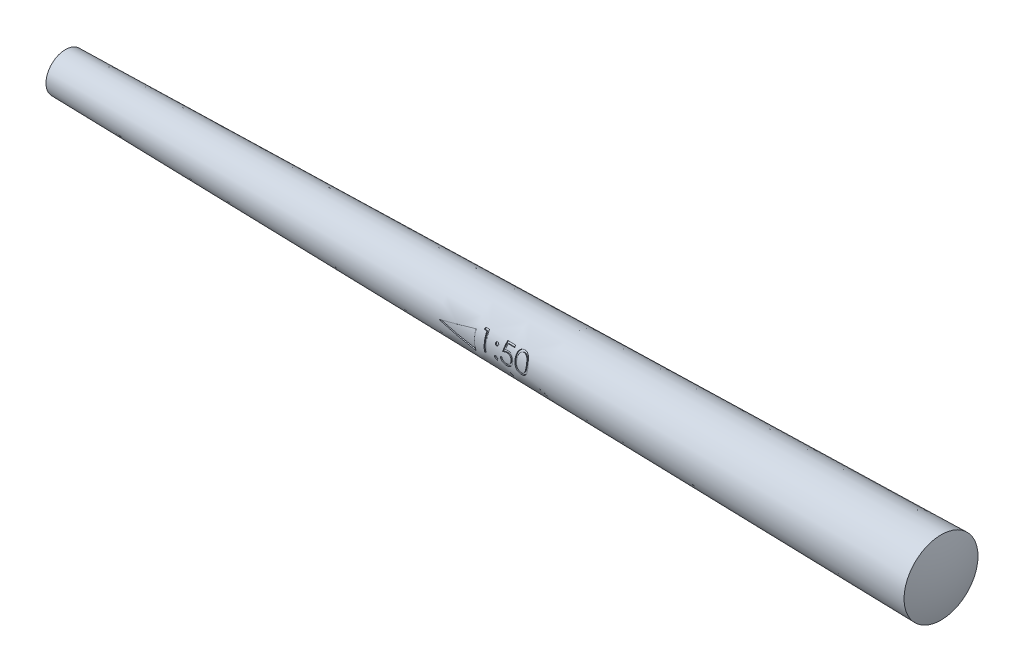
SolidWorks part; units mm, degrees
ref_plane "Front Plane" through (0, 0, 0) normal (0, 0, 1) x (1, 0, 0)
ref_plane "Top Plane" through (0, 0, 0) normal (0, 1, 0) x (1, 0, 0)
ref_plane "Right Plane" through (0, 0, 0) normal (1, 0, 0) x (0, 0, -1)
sketch "Sketch1" plane through (0, 0, 0) normal (1, 0, 0) x (0, 0, -1)
  circle A0 centre (0, 0) radius 1
  dimension "D1" = 2
extrude "Extrude1" add sketch "Sketch1" along normal mid plane 45
draft "Draft1" type of draft neutral plane draft angle 1.146 faces to draft 1 parameters "D1"=1.146
sketch "Sketch2" plane through (0, 0, 0) normal (0, 0, 1) x (1, 0, 0)
  line L0 (-22.5, 0) -> (-22.5, 1)
  line L1 (-22.5, 1) -> (-22.5, -1) construction
  line L2 (-22.5, 0) -> (-22.8, 0)
  line L3 (-22.8, 0) -> (-22.8, -1.45) construction
  line L4 (22.5, 0) -> (22.5, 1.9)
  line L5 (22.5, -1.9) -> (22.5, 1.9) construction
  line L6 (22.5, 0) -> (22.8, 0)
  line L7 (22.8, 0) -> (22.8, -1.45) construction
  line L8 (-22.5, -1) -> (22.5, -1.9) construction
  arc A0 (-22.8, 0) -> (-22.5, 1) centre (-20.9833, 0) cw
  arc A1 (22.8, 0) -> (22.5, 1.9) centre (16.6331, 0) ccw
  point P14 (0, -1.45)
revolve "Revolve1" add sketch "Sketch2" angle 360 about L2
sketch "Sketch5" plane through (0, 0, 0) normal (0, 0, 1) x (1, 0, 0)
  line L0 (0, 1.45) -> (0, -1.45) construction
  line L1 (22.5, 1.9) -> (-22.5, 1) construction
  line L2 (-22.5, -1) -> (22.5, -1.9) construction
ref_plane "Plane2" through (0, 0, 0) normal (-0.02, 0, 0.9998) x (0.9998, 0, 0.02)
sketch "Sketch6" plane through (0, 0, 0) normal (-0.02, 0, 0.9998) x (0.9998, 0, 0.02)
  line L0 (0, 0) -> (0, 0.5)
  line L1 (0, 1.45) -> (0, -1.45) construction
  line L2 (0, 0.5) -> (-1.866, 0)
  line L3 (-1.866, 0) -> (0, -0.5)
  line L4 (0, -0.5) -> (0, 0)
  line L5 (0, -0.25) -> (3, -0.25) construction
  text T0 "1:50" font "Century Gothic" height 1
  dimension "D1" = 1
  dimension "D2" = 30
  dimension "D3" = 3
wrap "Wrap2" sketch "Sketch6" wrap type deboss source sketch "Sketch6" thickness 0.05 parameters "D1"=0.05
equation "\"D2@Sketch2\" = \"D1@Sketch2\""
